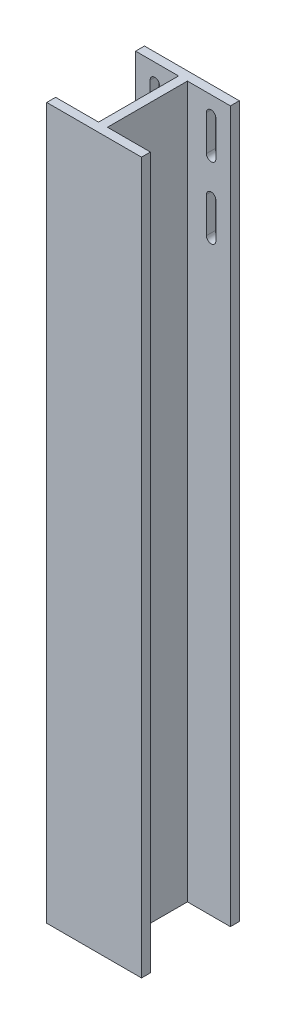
SolidWorks part; units mm, degrees
ref_plane "Front" through (0, 0, 0) normal (0, 0, 1) x (1, 0, 0)
ref_plane "Top" through (0, 0, 0) normal (0, 1, 0) x (1, 0, 0)
ref_plane "Right" through (0, 0, 0) normal (1, 0, 0) x (0, 0, -1)
sketch "Sketch1" plane through (0, 0, 0) normal (0, 1, 0) x (1, 0, 0)
  line L0 (0, 0) -> (101.6, 0)
  line L1 (0, 0) -> (0, 9.525)
  line L2 (101.6, 0) -> (101.6, 9.525)
  line L3 (0, 9.525) -> (46.0375, 9.525)
  line L4 (101.6, 9.525) -> (55.5625, 9.525)
  line L5 (55.5625, 9.525) -> (55.5625, 95.25)
  line L7 (46.0375, 95.25) -> (46.0375, 9.525)
  line L8 (-2.7487, 52.3875) -> (139.8248, 52.3875) construction
  line L9 (0, 95.25) -> (46.0375, 95.25)
  line L10 (101.6, 95.25) -> (55.5625, 95.25)
  line L11 (101.6, 104.775) -> (101.6, 95.25)
  line L12 (0, 104.775) -> (101.6, 104.775)
  line L13 (0, 104.775) -> (0, 95.25)
  dimension "D1" = 101.6
  dimension "D2" = 9.525
  dimension "D3" = 9.525
  dimension "D4" = 9.525
  dimension "D5" = 46.0375
extrude "Boss-Extrude1 L=26in" add sketch "Sketch1" along normal blind 762
sketch "Sketch6" plane through (0, 0, -104.775) normal (0, 0, -1) x (-1, 0, 0)
  line L0 (-101.6, 762) -> (-101.6, 0) construction
  line L1 (-101.6, 762) -> (0, 762) construction
  line L2 (-80.9625, 742.95) -> (-80.9625, 704.85) construction
  line L3 (-75.9206, 742.95) -> (-75.9206, 704.85)
  line L4 (-86.0044, 742.95) -> (-86.0044, 704.85)
  line L5 (-20.6375, 704.85) -> (-20.6375, 742.95) construction
  line L6 (-25.6794, 704.85) -> (-25.6794, 742.95)
  line L7 (-15.5956, 704.85) -> (-15.5956, 742.95)
  line L8 (-20.6375, 628.65) -> (-20.6375, 666.75) construction
  line L9 (-25.6794, 628.65) -> (-25.6794, 666.75)
  line L10 (-15.5956, 628.65) -> (-15.5956, 666.75)
  line L11 (-80.9625, 628.65) -> (-80.9625, 666.75) construction
  line L12 (-86.0044, 628.65) -> (-86.0044, 666.75)
  line L13 (-75.9206, 628.65) -> (-75.9206, 666.75)
  circle A0 centre (-80.9625, 723.9) radius 5.0419 construction
  circle A1 centre (-20.6375, 723.9) radius 5.0419 construction
  circle A2 centre (-20.6375, 647.7) radius 5.0419 construction
  circle A3 centre (-80.9625, 647.7) radius 5.0419 construction
  arc A4 (-75.9206, 742.95) -> (-86.0044, 742.95) centre (-80.9625, 742.95) ccw
  arc A5 (-86.0044, 704.85) -> (-75.9206, 704.85) centre (-80.9625, 704.85) ccw
  arc A6 (-25.6794, 704.85) -> (-15.5956, 704.85) centre (-20.6375, 704.85) ccw
  arc A7 (-15.5956, 742.95) -> (-25.6794, 742.95) centre (-20.6375, 742.95) ccw
  arc A8 (-25.6794, 628.65) -> (-15.5956, 628.65) centre (-20.6375, 628.65) ccw
  arc A9 (-15.5956, 666.75) -> (-25.6794, 666.75) centre (-20.6375, 666.75) ccw
  arc A10 (-86.0044, 628.65) -> (-75.9206, 628.65) centre (-80.9625, 628.65) ccw
  arc A11 (-75.9206, 666.75) -> (-86.0044, 666.75) centre (-80.9625, 666.75) ccw
  point P14 (-80.9625, 723.9)
  point P20 (-20.6375, 723.9)
  point P27 (-20.6375, 647.7)
  point P34 (-80.9625, 647.7)
  dimension "D1" = 10.0838
  dimension "D6" = 5.0419
  dimension "D2" = 76.2
  dimension "D3" = 60.325
  dimension "D4" = 20.6375
  dimension "D5" = 38.1
  dimension "D7" = 38.1
extrude "Cut-Extrude1" cut sketch "Sketch6" against normal up to next and the other way through all
sketch "3D print bottom half cut" plane through (0, 0, 0) normal (0, 0, 1) x (1, 0, 0)
  line L0 (101.6, 762) -> (101.6, 0) construction
  line L1 (0, 0) -> (101.6, 0)
  line L2 (0, 0) -> (0, 381)
  line L3 (0, 381) -> (101.6, 381)
  line L4 (101.6, 0) -> (101.6, 381)
  dimension "D1" = 381
sketch "3D print upper half cut" plane through (0, 0, 0) normal (0, 0, 1) x (1, 0, 0)
  line L1 (101.6, 762) -> (0, 762)
  line L2 (101.6, 762) -> (101.6, 381)
  line L3 (101.6, 381) -> (0, 381)
  line L4 (0, 762) -> (0, 381)
